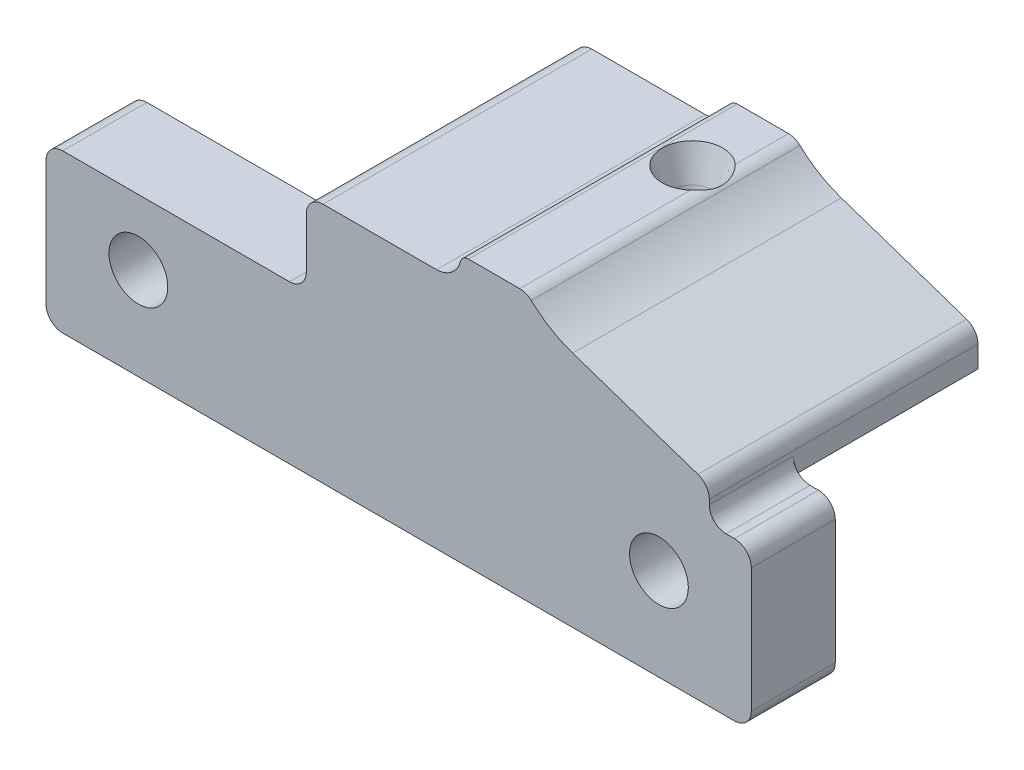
SolidWorks part; units mm, degrees
ref_plane "Front" through (0, 0, 0) normal (0, 0, 1) x (1, 0, 0)
ref_plane "Top" through (0, 0, 0) normal (0, 1, 0) x (1, 0, 0)
ref_plane "Right" through (0, 0, 0) normal (1, 0, 0) x (0, 0, -1)
sketch "Sketch1" plane through (0, 0, 0) normal (0, 0, 1) x (1, 0, 0)
  line L4 (1, 42) -> (41, 42)
  line L5 (42, 43) -> (42, 50.4)
  line L6 (41, 51.4) -> (1, 51.4)
  line L7 (0, 50.4) -> (0, 43)
  line L8 (1, 42) -> (41, 42)
  line L9 (42, 43) -> (42, 50.4)
  line L10 (41, 51.4) -> (1, 51.4)
  line L11 (0, 50.4) -> (0, 43)
  circle A0 centre (36.5, 78.5) radius 22.6941 construction
  circle A1 centre (36.5, 47.5) radius 1.75 construction
  circle A2 centre (36.5, 47.5) radius 1.75
  circle A3 centre (5.5, 47.5) radius 1.75 construction
  circle A4 centre (5.5, 47.5) radius 1.75
  arc A5 (0, 43) -> (1, 42) centre (1, 43) ccw
  arc A6 (41, 42) -> (42, 43) centre (41, 43) ccw
  arc A7 (42, 50.4) -> (41, 51.4) centre (41, 50.4) ccw
  arc A8 (1, 51.4) -> (0, 50.4) centre (1, 50.4) ccw
  arc A9 (0, 43) -> (1, 42) centre (1, 43) ccw
  arc A10 (41, 42) -> (42, 43) centre (41, 43) ccw
  arc A11 (42, 50.4) -> (41, 51.4) centre (41, 50.4) ccw
  arc A12 (1, 51.4) -> (0, 50.4) centre (1, 50.4) ccw
  dimension "D1" = 0
extrude "Boss-Extrude1" add sketch "Sketch1" along normal blind 5
sketch "Sketch2" plane through (0, 0, 5) normal (0, 0, 1) x (1, 0, 0)
  line L0 (15.5, 51.4) -> (15.5, 56.4)
  line L1 (41, 51.4) -> (1, 51.4) construction
  line L2 (15.5, 56.4) -> (23.2567, 56.4)
  line L3 (26.125, 57.9) -> (28.625, 57.9)
  line L4 (0, 50.4) -> (0, 43) construction
  line L5 (26.5, 68.688) -> (26.5, 56.5514) construction
  line L6 (28.25, 68.688) -> (28.25, 56.5514) construction
  line L7 (26.5, 60) -> (28.25, 60) construction
  line L8 (27.375, 60) -> (27.375, 57.1619) construction
  line L9 (41, 51.4) -> (1, 51.4) construction
  line L10 (31.363, 56.1529) -> (39.5, 53.4)
  line L11 (39.5, 53.4) -> (39.5, 51.4)
  line L12 (39.5, 51.4) -> (15.5, 51.4)
  line L13 (26.125, 57.9) -> (25.1615, 57.9)
  line L14 (24.725, 57.9) -> (24.725, 58.3936) construction
  arc A1 (28.625, 57.9) -> (37.279, 56.4598) centre (36.5, 78.5) ccw construction
  circle A2 centre (21, 63) radius 5.5 construction
  circle A3 centre (33.5372, 62.5792) radius 6.5 construction
  circle A4 centre (33.5372, 62.5792) radius 6.5 construction
  circle A5 centre (33.5372, 62.5792) radius 5.25 construction
  circle A6 centre (33.5372, 62.5792) radius 5.25 construction
  arc A7 (32.3479, 56.1889) -> (37.6208, 55.8336) centre (36.5, 78.5) ccw construction
  arc A8 (28.625, 57.9) -> (31.363, 56.1529) centre (33.5372, 62.5792) ccw
  arc A9 (24.6774, 57.525) -> (23.2567, 56.4) centre (23.2247, 57.9) cw
  arc A10 (25.1615, 57.9) -> (24.6774, 57.525) centre (25.1615, 57.4) ccw
  point P31 (27.375, 57.9)
  dimension "D7" = 1.5003
  dimension "D11" = 0.5
  dimension "D1" = 15.5
  dimension "D2" = 5
  dimension "D3" = 1.75
  dimension "D4" = 3
  dimension "D5" = 6.5
  dimension "D6" = 2.5
  dimension "D8" = 2
  dimension "D9" = 24
  dimension "D10" = 1.4
extrude "Boss-Extrude2" add sketch "Sketch2" against normal blind 16
sketch "Sketch4" plane through (0, 42, 0) normal (0, -1, 0) x (1, 0, 0)
  circle A0 centre (27, -6.5) radius 1
  dimension "D1" = 2
extrude "Cut-Extrude2" cut sketch "Sketch4" against normal through all
sketch "Sketch5" plane through (0, 51.4, 0) normal (0, -1, 0) x (1, 0, 0)
  line L4 (39.5, 0) -> (15.5, 0)
  line L5 (15.5, 0) -> (15.5, -11)
  line L6 (15.5, -11) -> (39.5, -11)
  line L7 (39.5, -11) -> (39.5, 0)
  line L8 (39.5, 0) -> (15.5, 0)
  line L9 (15.5, 0) -> (15.5, -11)
  line L10 (15.5, -11) -> (39.5, -11)
  line L11 (39.5, -11) -> (39.5, 0)
  circle A2 centre (27, -6.5) radius 1 construction
  circle A3 centre (27, -6.5) radius 1
  circle A6 centre (27, -6.5) radius 2.1585
  circle A7 centre (27, -6.5) radius 2.1585
  dimension "D1" = 0
  dimension "D2" = 0.3
extrude "Boss-Extrude3" add sketch "Sketch5" along normal blind 5 contours A7 M6
fillet "Fillet1" radius 1 1 edges at (28.625, 57.9, -3)
fillet "Fillet2" radius 1 3 edges at (15.5, 56.4, -3) (39.5, 53.4, -3) (39.5, 51.4, 2.5)
sketch "Sketch6" plane through (0, 57.9, 0) normal (0, 1, 0) x (1, 0, 0)
  circle A2 centre (27, 6.5) radius 1.8
  circle A3 centre (27, 6.5) radius 1.8
  dimension "D1" = 0.8
extrude "Cut-Extrude3" cut sketch "Sketch6" against normal blind 10 draft 18
fillet "Fillet3" radius 4 1 edges at (27, 55.4379, -5.5)
sketch "Sketch7" plane through (0, 0, 5) normal (0, 0, 1) x (1, 0, 0)
  circle A0 centre (36.5, 47.5) radius 3 construction
  circle A1 centre (36.5, 47.5) radius 3
  circle A2 centre (5.5, 47.5) radius 3 construction
  circle A3 centre (5.5, 47.5) radius 3
fillet "Fillet4" radius 1 1 edges at (15.5, 51.4, 2.5)
